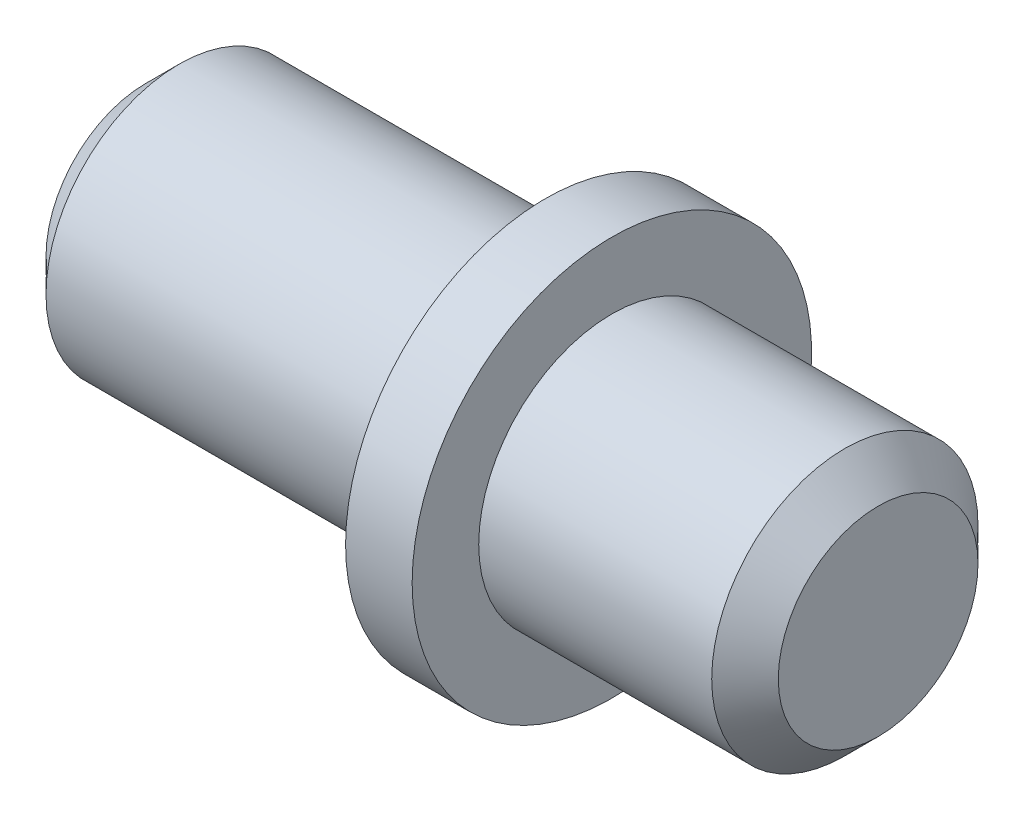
SolidWorks part; units mm, degrees
ref_plane "Plan de face" through (0, 0, 0) normal (0, 0, 1) x (1, 0, 0)
ref_plane "Plan de dessus" through (0, 0, 0) normal (0, 1, 0) x (1, 0, 0)
ref_plane "Plan de droite" through (0, 0, 0) normal (1, 0, 0) x (0, 0, -1)
sketch "Esquisse1" plane through (0, 0, 0) normal (0, 0, 1) x (1, 0, 0)
  line L0 (0, 0) -> (22.9545, 0) construction
  line L1 (0, 0) -> (0, 2)
  line L2 (0, 2) -> (-4, 2)
  line L3 (-4, 2) -> (-4, 3)
  line L4 (-4, 3) -> (-5, 3)
  line L5 (-5, 3) -> (-5, 2)
  line L6 (-5, 2) -> (-11, 2)
  line L7 (-11, 2) -> (-11, 0)
  line L8 (-11, 0) -> (0, 0)
  dimension "D1" = 4
  dimension "D2" = 4
  dimension "D3" = 6
  dimension "D4" = 4
  dimension "D5" = 11
  dimension "D6" = 6
revolve "Révolution1" add sketch "Esquisse1" angle 360 about L0
chamfer "Chanfrein1" distance 0.5 angle 45 2 edges at (0, 0, 2) (-11, 0, 2)
